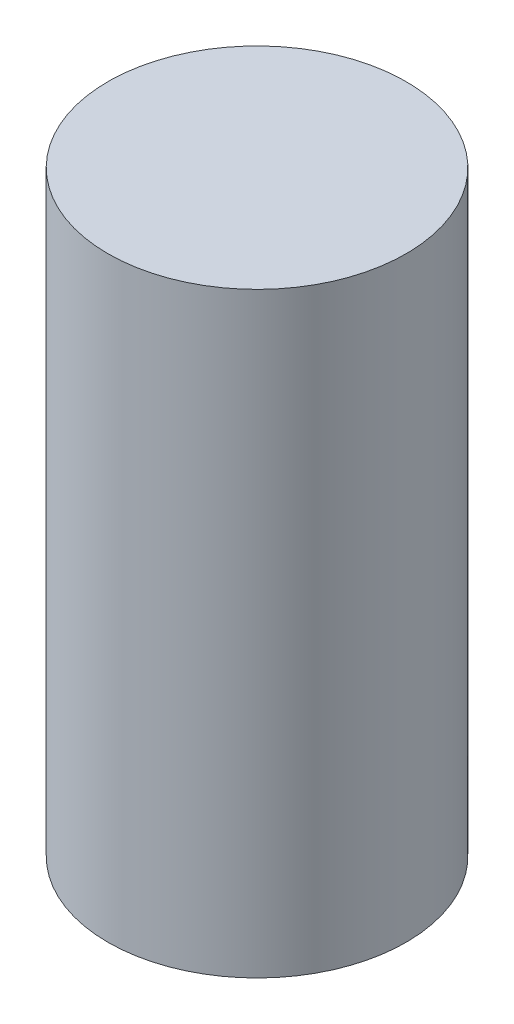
SolidWorks part; units mm, degrees
ref_plane "Alzado" through (0, 0, 0) normal (0, 0, 1) x (1, 0, 0)
ref_plane "Planta" through (0, 0, 0) normal (0, 1, 0) x (1, 0, 0)
ref_plane "Vista lateral" through (0, 0, 0) normal (1, 0, 0) x (0, 0, -1)
sketch "Croquis1" plane through (0, 0, 0) normal (0, 1, 0) x (1, 0, 0)
  circle A0 centre (0, 0) radius 2.5
  dimension "D1" = 5
extrude "Saliente-Extruir1" add sketch "Croquis1" along normal mid plane 10
